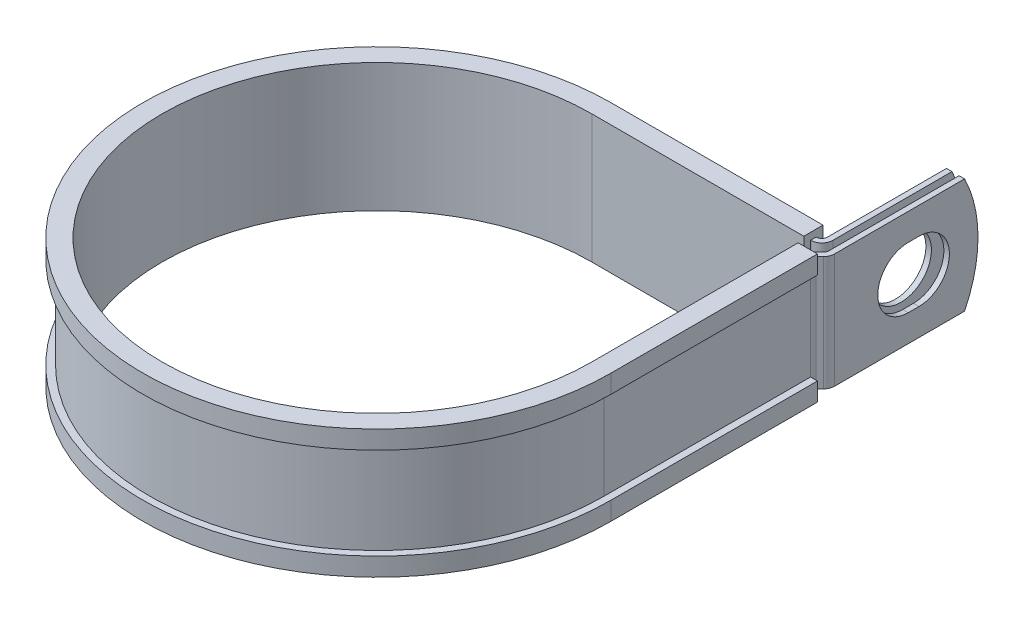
SolidWorks part; units mm, degrees
ref_plane "Front Plane" through (0, 0, 0) normal (0, 0, 1) x (1, 0, 0)
ref_plane "Top Plane" through (0, 0, 0) normal (0, 1, 0) x (1, 0, 0)
ref_plane "Right Plane" through (0, 0, 0) normal (1, 0, 0) x (0, 0, -1)
sketch "Sketch1" plane through (0, 0, 0) normal (0, 1, 0) x (1, 0, 0)
  line L0 (0, 49.149) -> (47.0333, 49.149)
  line L1 (49.149, 0) -> (49.149, 45.7365)
  line L2 (49.4717, 80.9498) -> (49.4717, 51.5874)
  line L3 (49.8632, 47.4607) -> (50.6894, 48.2869)
  line L5 (51.0465, 49.149) -> (51.0465, 80.9498)
  arc A0 (0, 49.149) -> (49.149, 0) centre (0, 0) ccw
  arc A1 (49.8632, 47.4607) -> (49.149, 45.7365) centre (51.5874, 45.7365) ccw
  arc A2 (50.6894, 48.2869) -> (51.0465, 49.149) centre (49.8273, 49.149) ccw
  arc A3 (47.0333, 49.149) -> (49.4717, 51.5874) centre (47.0333, 51.5874) ccw
extrude "Extrude-Thin1" add sketch "Sketch1" along normal mid plane 25.4 thin
sketch "Sketch2" plane through (48.2525, 0, 0) normal (-1, 0, 0) x (0, 0, 1)
  line L0 (-80.9498, 12.7) -> (-80.9498, -12.7) construction
  line L1 (0, 12.7) -> (0, -12.7) construction
  circle A0 centre (-66.675, 0) radius 6.7437
  point P2 (-80.9498, 0)
extrude "Cut-Extrude1" cut sketch "Sketch2" against normal up to surface (1.2192 mm away)
sketch "Sketch3" plane through (52.2657, 0, 0) normal (1, 0, 0) x (0, 0, -1)
  line L0 (65.4812, 0) -> (67.8688, 0) construction
  line L1 (65.4812, 6.7437) -> (67.8688, 6.7437)
  line L2 (65.4812, -6.7437) -> (67.8688, -6.7437)
  line L3 (80.9498, 12.7) -> (80.9498, -12.7) construction
  arc A0 (65.4812, 6.7437) -> (65.4812, -6.7437) centre (65.4812, 0) ccw
  arc A1 (67.8688, -6.7437) -> (67.8688, 6.7437) centre (67.8688, 0) ccw
  point P3 (66.675, 0)
  point P8 (80.9498, 0)
  point P11 (58.7375, 0)
  point P12 (74.6125, 0)
extrude "Cut-Extrude2" cut sketch "Sketch3" against normal up to surface (1.2192 mm away)
sketch "Sketch4" plane through (48.2525, 0, 0) normal (-1, 0, 0) x (0, 0, 1)
  line L0 (-80.9498, 12.7) -> (-80.9498, -12.7)
  line L1 (-80.9498, 12.7) -> (-77.9725, 12.7)
  line L2 (-80.9498, 12.7) -> (-51.5874, 12.7) construction
  line L3 (-80.9498, -12.7) -> (-77.9725, -12.7)
  line L4 (-80.9498, -12.7) -> (-51.5874, -12.7) construction
  arc A0 (-77.9725, 12.7) -> (-77.9725, -12.7) centre (-52.3748, 0) ccw
extrude "Cut-Extrude3" cut sketch "Sketch4" against normal through all contours A0 M4 M5 | A0 L0 M2
ref_plane "Plane1" through (0, 0, -45.7365) normal (0, 0, -1) x (-1, 0, 0)
ref_plane "Plane2" through (46.9825, 0, 0) normal (-1, 0, 0) x (0, 0, 1)
sketch "Sketch5" plane through (0, 0, -45.7365) normal (0, 0, -1) x (-1, 0, 0)
  line L0 (-50.3682, 12.7) -> (-49.149, 12.7)
  line L1 (-50.3682, 12.7) -> (-50.3682, -12.7) construction
  line L3 (-49.149, 12.7) -> (-49.149, -12.7)
  line L4 (-49.149, -12.7) -> (-50.3682, -12.7)
  line L5 (-50.3682, -12.7) -> (-50.3682, -10.16)
  line L6 (-50.3682, 12.7) -> (-50.3682, 10.16)
  line L7 (-51.8922, 14.224) -> (-51.8922, 10.16)
  line L8 (-51.8922, 14.224) -> (-47.625, 14.224)
  line L9 (-47.625, 14.224) -> (-47.625, -14.224)
  line L10 (-47.625, -14.224) -> (-51.8922, -14.224)
  line L11 (-51.8922, -14.224) -> (-51.8922, -10.16)
  line L12 (-51.8922, 10.16) -> (-50.3682, 10.16)
  line L13 (-50.3682, -10.16) -> (-51.8922, -10.16)
sketch "Sketch6" plane through (0, 12.7, 0) normal (0, 1, 0) x (1, 0, 0)
  line L0 (47.625, 0) -> (47.625, 45.7365)
  line L1 (47.625, 45.7365) -> (51.8922, 45.7365) construction
  line L2 (46.9825, 6.9878) -> (46.9825, -6.9878) construction
  line L5 (0, 47.625) -> (46.9825, 47.625)
  arc A0 (0, 47.625) -> (47.625, 0) centre (0, 0) ccw
sweep "Sweep1" add profiles "Sketch5" path "Sketch6"
equation "\"D4@Sketch5\" = \"D1@Extrude-Thin1\""
equation "\"D5@Sketch5\" = \"D5@Extrude-Thin1\""
equation "\"D1@Sketch3\" = \"D2@Sketch2\""
equation "\"D7@Sketch1\" = \"D3@Sketch2\" + \"D1@Sketch3\""
equation "\"D1@Sketch1\" = \"D1@Sketch6\" + 2 * \"D3@Sketch5\""
equation "\"D1@Sketch4\" = ( \"D1@Extrude-Thin1\" + .125 ) * 2"
equation "\"D9@Sketch1\"= \"D5@Extrude-Thin1\""
equation "\"D8@Sketch1\"= 2 * \"D5@Extrude-Thin1\""
equation "\"D2@Sketch1\" = 2 * \"D5@Extrude-Thin1\""
equation "\"D2@Sketch3\" = \"D1@Sketch2\""
